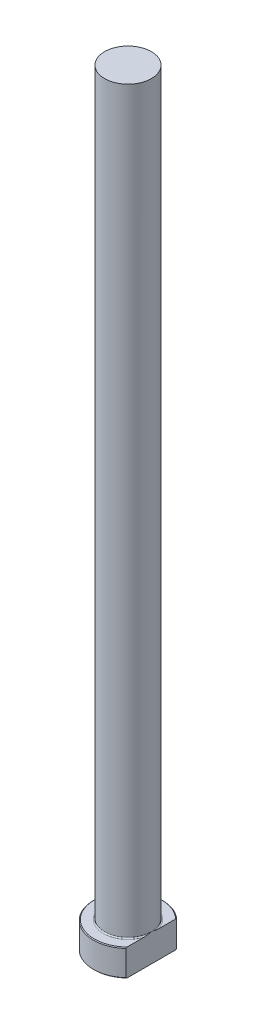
SolidWorks part; units mm, degrees
ref_plane "Front Plane" through (0, 0, 0) normal (0, 0, 1) x (1, 0, 0)
ref_plane "Top Plane" through (0, 0, 0) normal (0, 1, 0) x (1, 0, 0)
ref_plane "Right Plane" through (0, 0, 0) normal (1, 0, 0) x (0, 0, -1)
sketch "Sketch1" plane through (0, 0, 0) normal (0, 0, 1) x (1, 0, 0)
  line L0 (0, 259.9588) -> (0, -15.1925) construction
  line L1 (0, 0) -> (-9, 0)
  line L2 (-9, 0) -> (-9, 7)
  line L3 (-9, 7) -> (-6.1, 7)
  line L4 (-6.1, 7) -> (-6.1, 200)
  line L5 (-6.1, 200) -> (0, 200)
  line L6 (0, 200) -> (0, 0)
  dimension "L" = 200
  dimension "H" = 18
  dimension "T" = 7
  dimension "D" = 12.2
revolve "Revolve1" add sketch "Sketch1" angle 360 about L0
chamfer "Chamfer1" distance 0.2 angle 45 2 edges at (0, 7, 9) (0, 0, 9)
fillet "Fillet1" radius 0.3 1 edges at (0, 7, 6.1)
sketch "Sketch2" plane through (0, 0, 0) normal (0, 1, 0) x (1, 0, 0)
  line L0 (6.1, 6.6174) -> (6.1, -6.6174)
  circle A0 centre (0, 0) radius 9 construction
  arc A1 (6.1, -6.6174) -> (6.1, 6.6174) centre (0, 0) ccw
  circle A2 centre (0, 0) radius 6.1 construction
extrude "KEY" cut sketch "Sketch2" along normal through all
